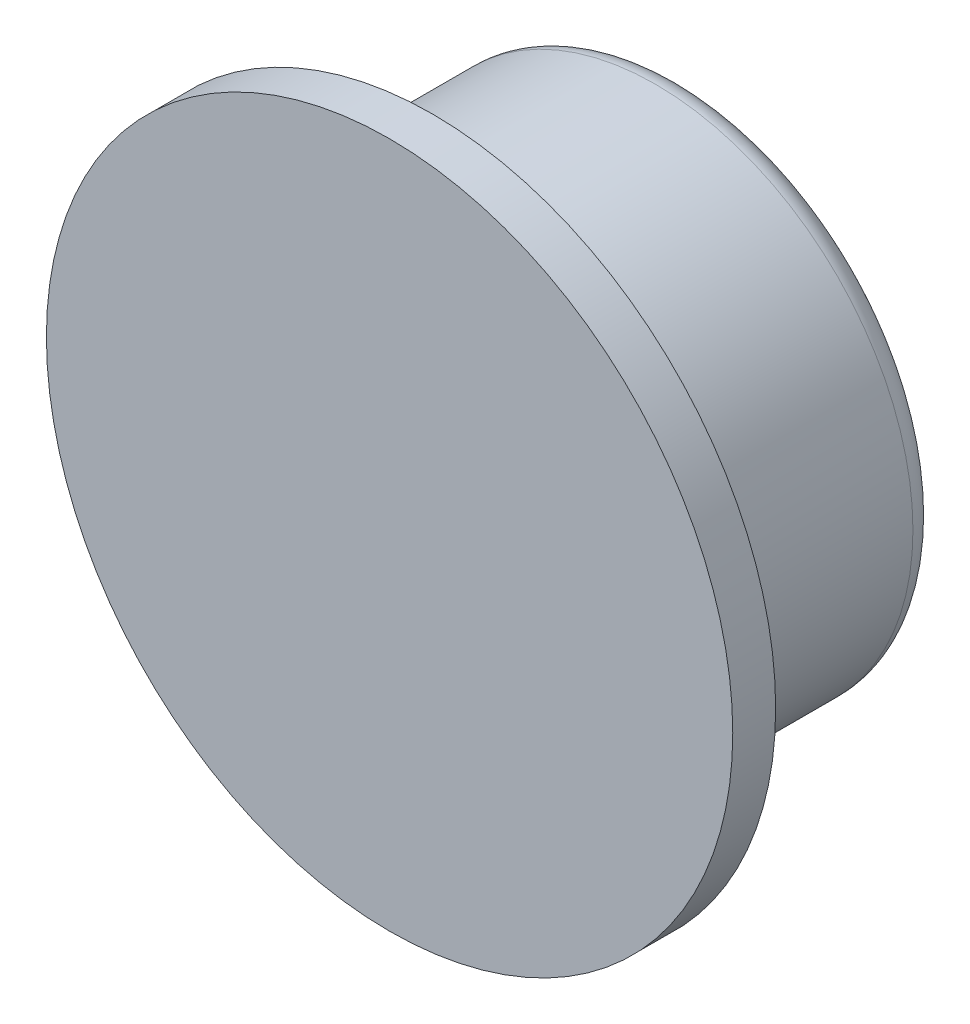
SolidWorks part; units mm, degrees
ref_plane "Front Plane" through (0, 0, 0) normal (0, 0, 1) x (1, 0, 0)
ref_plane "Top Plane" through (0, 0, 0) normal (0, 1, 0) x (1, 0, 0)
ref_plane "Right Plane" through (0, 0, 0) normal (1, 0, 0) x (0, 0, -1)
sketch "Sketch1" plane through (0, 0, 0) normal (1, 0, 0) x (0, 0, -1)
  line L0 (0, 0) -> (34, 0) construction
  line L1 (0, 0) -> (0, 40)
  line L2 (0, 40) -> (5, 40)
  line L3 (5, 40) -> (5, 30)
  line L4 (5, 30) -> (31, 30)
  line L5 (34, 27) -> (34, 5.5)
  line L6 (33.5, 5) -> (25, 5)
  line L7 (25, 5) -> (22.1132, 0)
  line L8 (33.5, 5) -> (34, 5.5)
  line L9 (0, 0) -> (22.1132, 0)
  arc A0 (31, 30) -> (34, 27) centre (31, 27) cw
  dimension "D1" = 3
  dimension "D2" = 5
  dimension "D3" = 29
  dimension "D4" = 30
  dimension "D5" = 40
  dimension "D6" = 9
  dimension "D7" = 60
  dimension "D8" = 45
  dimension "D9" = 0.5
  dimension "D10" = 5
revolve "Revolve1" add sketch "Sketch1" angle 360 about L0
